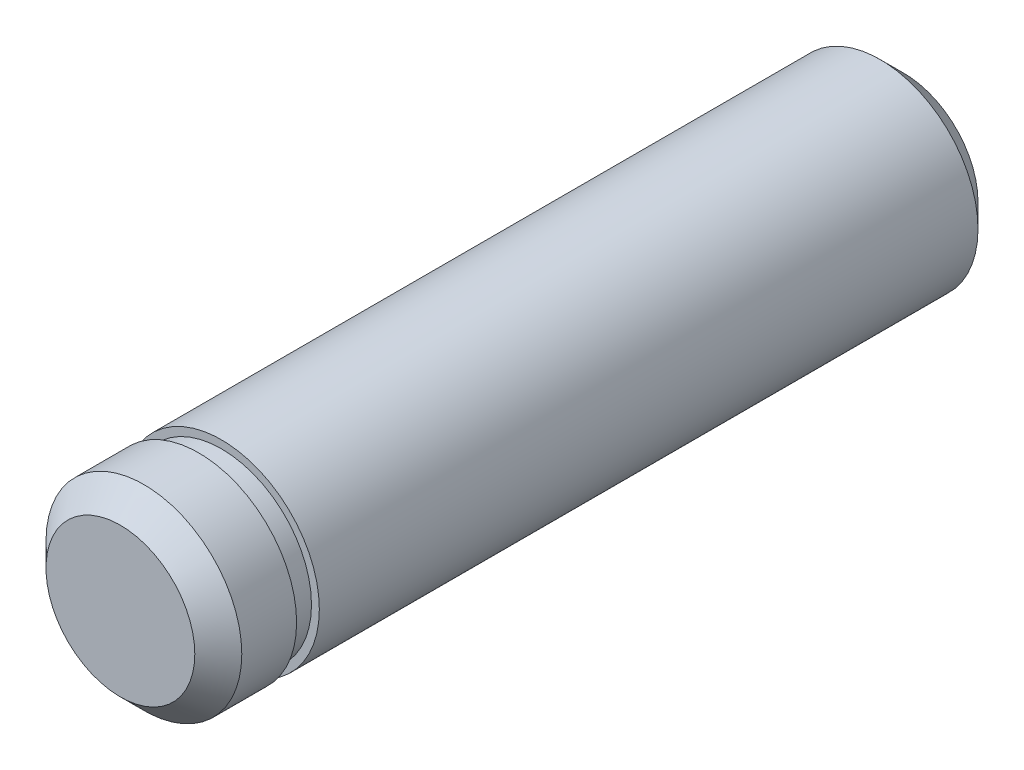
SolidWorks part; units mm, degrees
ref_plane "Front Plane" through (0, 0, 0) normal (0, 0, 1) x (1, 0, 0)
ref_plane "Top Plane" through (0, 0, 0) normal (0, 1, 0) x (1, 0, 0)
ref_plane "Right Plane" through (0, 0, 0) normal (1, 0, 0) x (0, 0, -1)
sketch "Sketch1" plane through (0, 0, 0) normal (0, 0, 1) x (1, 0, 0)
  circle A0 centre (0, 0) radius 3.175
  dimension "D1" = 6.35
extrude "Boss-Extrude1" add sketch "Sketch1" along normal blind 25.4
chamfer "Chamfer1" distance 0.762 angle 45 2 edges at (3.175, 0, 25.4) (3.175, 0, 0)
sketch "Sketch2" plane through (0, 0, 25.4) normal (0, 0, 1) x (1, 0, 0)
  circle A0 centre (0, 0) radius 2.921
  circle A1 centre (0, 0) radius 3.175 construction
  circle A2 centre (0, 0) radius 3.175
  dimension "D1" = 5.842
extrude "Cut-Extrude1" cut sketch "Sketch2" against normal blind 0.7366 from offset 2.54
